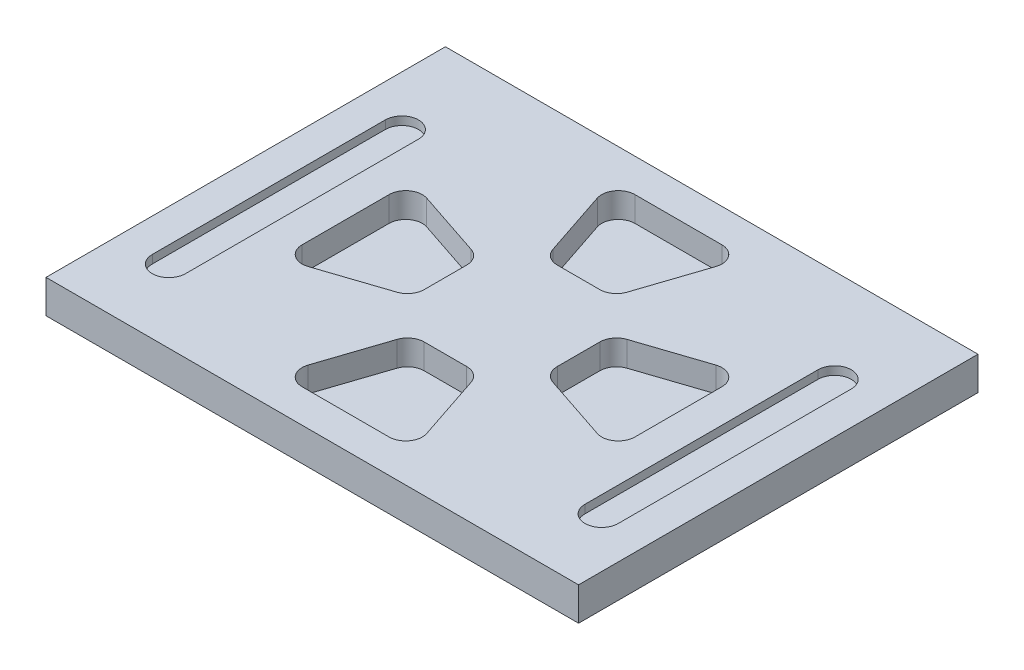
SolidWorks part; units mm, degrees
ref_plane "Front Plane" through (0, 0, 0) normal (0, 0, 1) x (1, 0, 0)
ref_plane "Top Plane" through (0, 0, 0) normal (0, 1, 0) x (1, 0, 0)
ref_plane "Right Plane" through (0, 0, 0) normal (1, 0, 0) x (0, 0, -1)
sketch "Sketch1" plane through (0, 0, 0) normal (0, 1, 0) x (1, 0, 0)
  line L1 (-203.2, -152.4) -> (203.2, -152.4)
  line L2 (-203.2, -152.4) -> (-203.2, 152.4)
  line L3 (-203.2, 152.4) -> (203.2, 152.4)
  line L4 (203.2, -152.4) -> (203.2, 152.4)
  line L5 (-203.2, -152.4) -> (203.2, 152.4) construction
  line L6 (-203.2, 152.4) -> (203.2, -152.4) construction
  point P0 (0, 0)
  dimension "D1" = 304.8
  dimension "D2" = 406.4
extrude "Boss-Extrude1" add sketch "Sketch1" against normal blind 25.4
sketch "Sketch2" plane through (0, 0, 0) normal (0, 1, 0) x (1, 0, 0)
  line L0 (-127, 33.1797) -> (-127, -33.1797)
  line L1 (-110.2839, -45.228) -> (-59.4839, -28.2946)
  line L2 (-50.8, -16.2464) -> (-50.8, 16.2464)
  line L3 (-59.4839, 28.2946) -> (-110.2839, 45.228)
  line L4 (-203.2, 0) -> (203.2, 0) construction
  line L5 (-203.2, 152.4) -> (-203.2, -152.4) construction
  line L6 (203.2, -152.4) -> (203.2, 152.4) construction
  line L7 (33.1797, 127) -> (-33.1797, 127)
  line L8 (-45.228, 110.2839) -> (-28.2946, 59.4839)
  line L9 (-16.2464, 50.8) -> (16.2464, 50.8)
  line L10 (28.2946, 59.4839) -> (45.228, 110.2839)
  line L11 (127, -33.1797) -> (127, 33.1797)
  line L12 (110.2839, 45.228) -> (59.4839, 28.2946)
  line L13 (50.8, 16.2464) -> (50.8, -16.2464)
  line L14 (59.4839, -28.2946) -> (110.2839, -45.228)
  line L15 (-33.1797, -127) -> (33.1797, -127)
  line L16 (45.228, -110.2839) -> (28.2946, -59.4839)
  line L17 (16.2464, -50.8) -> (-16.2464, -50.8)
  line L18 (-28.2946, -59.4839) -> (-45.228, -110.2839)
  line L19 (0, 0) -> (-50.8, -16.2464) construction
  arc A0 (-50.8, 16.2464) -> (-59.4839, 28.2946) centre (-63.5, 16.2464) ccw
  arc A1 (-59.4839, -28.2946) -> (-50.8, -16.2464) centre (-63.5, -16.2464) ccw
  arc A2 (-127, -33.1797) -> (-110.2839, -45.228) centre (-114.3, -33.1797) ccw
  arc A3 (-127, 33.1797) -> (-110.2839, 45.228) centre (-114.3, 33.1797) cw
  arc A4 (16.2464, 50.8) -> (28.2946, 59.4839) centre (16.2464, 63.5) ccw
  arc A5 (-28.2946, 59.4839) -> (-16.2464, 50.8) centre (-16.2464, 63.5) ccw
  arc A6 (-33.1797, 127) -> (-45.228, 110.2839) centre (-33.1797, 114.3) ccw
  arc A7 (33.1797, 127) -> (45.228, 110.2839) centre (33.1797, 114.3) cw
  arc A8 (50.8, -16.2464) -> (59.4839, -28.2946) centre (63.5, -16.2464) ccw
  arc A9 (59.4839, 28.2946) -> (50.8, 16.2464) centre (63.5, 16.2464) ccw
  arc A10 (127, 33.1797) -> (110.2839, 45.228) centre (114.3, 33.1797) ccw
  arc A11 (127, -33.1797) -> (110.2839, -45.228) centre (114.3, -33.1797) cw
  arc A12 (-16.2464, -50.8) -> (-28.2946, -59.4839) centre (-16.2464, -63.5) ccw
  arc A13 (28.2946, -59.4839) -> (16.2464, -50.8) centre (16.2464, -63.5) ccw
  arc A14 (33.1797, -127) -> (45.228, -110.2839) centre (33.1797, -114.3) ccw
  arc A15 (-33.1797, -127) -> (-45.228, -110.2839) centre (-33.1797, -114.3) cw
  point P10 (-50.8, 0)
  point P11 (-127, 0)
  point P14 (-50.8, 25.4)
  point P17 (-50.8, -25.4)
  point P20 (-127, -50.8)
  point P23 (-127, 50.8)
  point P24 (0, 0)
  dimension "D5" = 12.7
  dimension "D1" = 76.2
  dimension "D2" = 101.6
  dimension "D3" = 76.2
  dimension "D4" = 50.8
  dimension "D6" = 53.3346
extrude "Cut-Extrude2" cut sketch "Sketch2" against normal blind 19.05
sketch "Sketch3" plane through (0, 0, 0) normal (0, 1, 0) x (1, 0, 0)
  line L0 (-165.1, -96.7083) -> (-165.1, 81.0917) construction
  line L1 (-177.8, -96.7083) -> (-177.8, 81.0917)
  line L2 (-152.4, -96.7083) -> (-152.4, 81.0917)
  line L3 (-203.2, 152.4) -> (-203.2, -152.4) construction
  line L4 (0, 0) -> (0, 152.4) construction
  line L5 (203.2, 152.4) -> (-203.2, 152.4) construction
  line L6 (165.1, -96.7083) -> (165.1, 81.0917) construction
  line L7 (177.8, -96.7083) -> (177.8, 81.0917)
  line L8 (152.4, -96.7083) -> (152.4, 81.0917)
  arc A0 (-177.8, -96.7083) -> (-152.4, -96.7083) centre (-165.1, -96.7083) ccw
  arc A1 (-152.4, 81.0917) -> (-177.8, 81.0917) centre (-165.1, 81.0917) ccw
  arc A2 (177.8, -96.7083) -> (152.4, -96.7083) centre (165.1, -96.7083) cw
  arc A3 (152.4, 81.0917) -> (177.8, 81.0917) centre (165.1, 81.0917) cw
  point P2 (-165.1, -7.8083)
  point P16 (165.1, -7.8083)
  dimension "D3" = 12.7
  dimension "D1" = 177.8
  dimension "D2" = 38.1
extrude "Cut-Extrude3" cut sketch "Sketch3" against normal blind 6.35
sketch "Sketch4" plane through (0, -25.4, 0) normal (0, -1, 0) x (1, 0, 0)
  line L0 (165.1, 88.9) -> (165.1, -88.9) construction
  line L1 (177.8, 88.9) -> (177.8, -88.9)
  line L2 (152.4, 88.9) -> (152.4, -88.9)
  line L3 (203.2, 152.4) -> (203.2, -152.4) construction
  line L4 (0, 0) -> (0, -152.4) construction
  line L5 (203.2, -152.4) -> (-203.2, -152.4) construction
  line L6 (-165.1, 88.9) -> (-165.1, -88.9) construction
  line L7 (-177.8, 88.9) -> (-177.8, -88.9)
  line L8 (-152.4, 88.9) -> (-152.4, -88.9)
  line L9 (203.2, 0) -> (-203.2, 0) construction
  line L10 (-203.2, -152.4) -> (-203.2, 152.4) construction
  arc A0 (177.8, 88.9) -> (152.4, 88.9) centre (165.1, 88.9) ccw
  arc A1 (152.4, -88.9) -> (177.8, -88.9) centre (165.1, -88.9) ccw
  arc A2 (-177.8, 88.9) -> (-152.4, 88.9) centre (-165.1, 88.9) cw
  arc A3 (-152.4, -88.9) -> (-177.8, -88.9) centre (-165.1, -88.9) cw
  point P2 (165.1, 0)
  point P16 (-165.1, 0)
  dimension "D3" = 12.7
  dimension "D1" = 38.1
  dimension "D2" = 177.8
extrude "Cut-Extrude4" cut sketch "Sketch4" against normal blind 6.35
